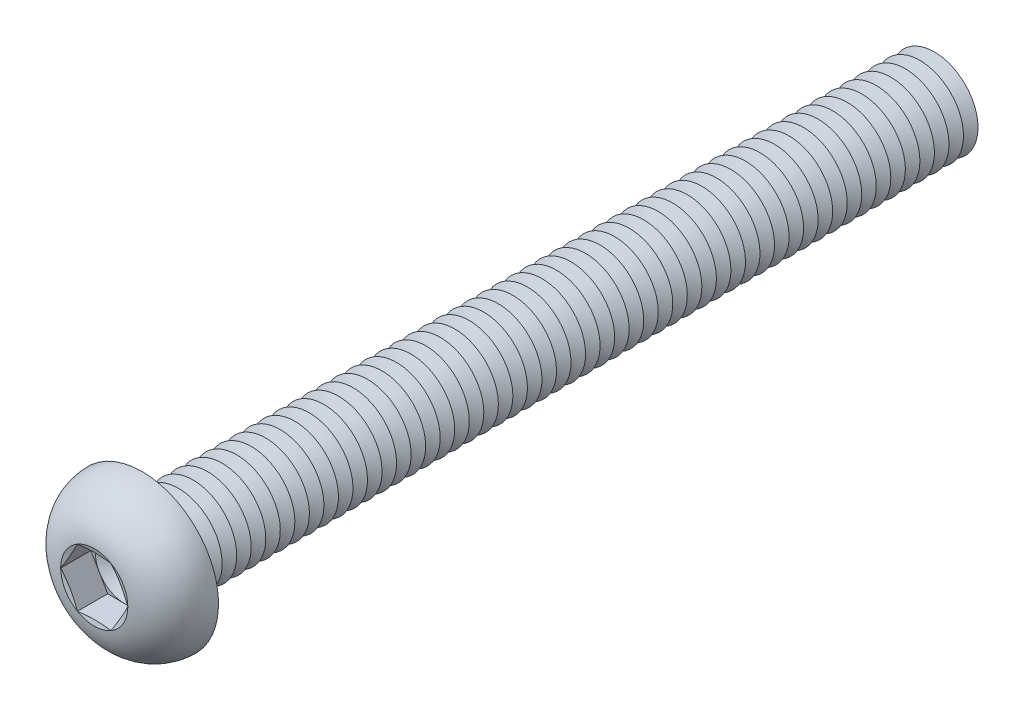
SolidWorks part; units mm, degrees
ref_plane "Front Plane" through (0, 0, 0) normal (0, 0, 1) x (1, 0, 0)
ref_plane "Top Plane" through (0, 0, 0) normal (0, 1, 0) x (1, 0, 0)
ref_plane "Right Plane" through (0, 0, 0) normal (1, 0, 0) x (0, 0, -1)
sketch "Sketch1" plane through (0, 0, 0) normal (1, 0, 0) x (0, 0, -1)
  line L0 (0, 3) -> (0, 5.25)
  line L3 (0, 3) -> (55, 3)
  line L4 (55, 3) -> (55, 0)
  line L5 (55, 0) -> (-3.3, 0) construction
  line L6 (-3.3, 0) -> (55, 0)
  line L7 (-3.3, 2.3094) -> (-3.3, 1.1547) construction
  line L8 (-3.3, 1.1547) -> (-3.3, 0)
  line L9 (-3.3, 2.3094) -> (-2.9906, 1.1547)
  line L10 (-2.9906, 1.1547) -> (-3.3, 1.1547)
  line L11 (55, 0) -> (22.7481, 0) construction
  line L12 (0, 5.25) -> (-3.3, 5.25) construction
  arc A1 (0, 5.25) -> (-3.3, 2.3094) centre (0, 1.928) ccw
  point P8 (55, 1.5)
  dimension "D1" = 10.5
  dimension "D2" = 6
  dimension "D3" = 3.3
  dimension "D4" = 4.6188
  dimension "D5" = 55
  dimension "D6" = 15
revolve "Revolve1" add sketch "Sketch1" angle 360 about L5
fillet "Fillet1" radius 0.5 1 edges at (0, 3, 0)
sketch "Sketch2" plane through (0, 0, 0) normal (1, 0, 0) x (0, 0, -1)
  line L0 (54.5, 3) -> (55.5, 3)
  line L1 (55, 3) -> (0.5, 3) construction
  line L2 (55.5, 3) -> (55, 2.134)
  line L3 (55, -3) -> (55, 3) construction
  line L4 (55, 2.134) -> (54.5, 3)
  dimension "D1" = 1
revolve "Cut-Revolve1" cut sketch "Sketch2" angle 360 about axis through (0, 0, -55) along (0, 0, -1)
pattern_linear "LPattern1" count 55 spacing 1 along (0, 0, 1) of "Cut-Revolve1"
sketch "Sketch3" plane through (0, 0, 3.3) normal (0, 0, 1) x (1, 0, 0)
  line L7 (1.1547, 2) -> (-1.1547, 2)
  line L8 (-1.1547, 2) -> (-2.3094, 0)
  line L9 (-2.3094, 0) -> (-1.1547, -2)
  line L10 (-1.1547, -2) -> (1.1547, -2)
  line L11 (1.1547, -2) -> (2.3094, 0)
  line L12 (2.3094, 0) -> (1.1547, 2)
  circle A0 centre (0, 0) radius 2 construction
  circle A3 centre (0, 0) radius 2.3094 construction
extrude "Cut-Extrude1" cut sketch "Sketch3" against normal blind 2.08
sketch "Sketch4" plane through (0, 0, 1.22) normal (0, 0, 1) x (1, 0, 0)
  line L1 (1.1547, 2) -> (-1.1547, 2) construction
  circle A0 centre (0, 0) radius 2
extrude "Cut-Extrude2" cut sketch "Sketch4" against normal through all draft 60
